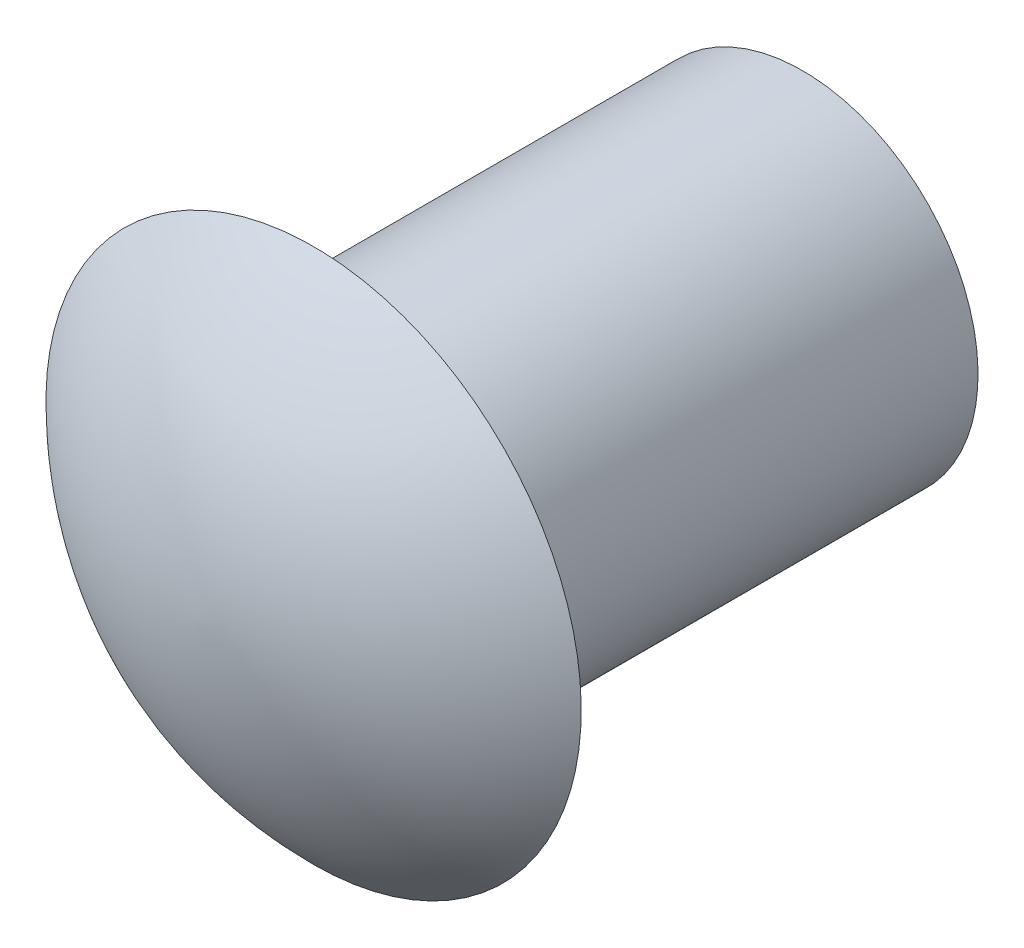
SolidWorks part; units mm, degrees
other "<Lock Rivet_01>-<Revolve1>"
ref_plane "Front Plane" through (0, 0, 0) normal (0, 0, 1) x (1, 0, 0)
ref_plane "Top Plane" through (0, 0, 0) normal (0, 1, 0) x (1, 0, 0)
ref_plane "Right Plane" through (0, 0, 0) normal (1, 0, 0) x (0, 0, -1)
mirrored part "Lock Rivet_01_Mirrored"
